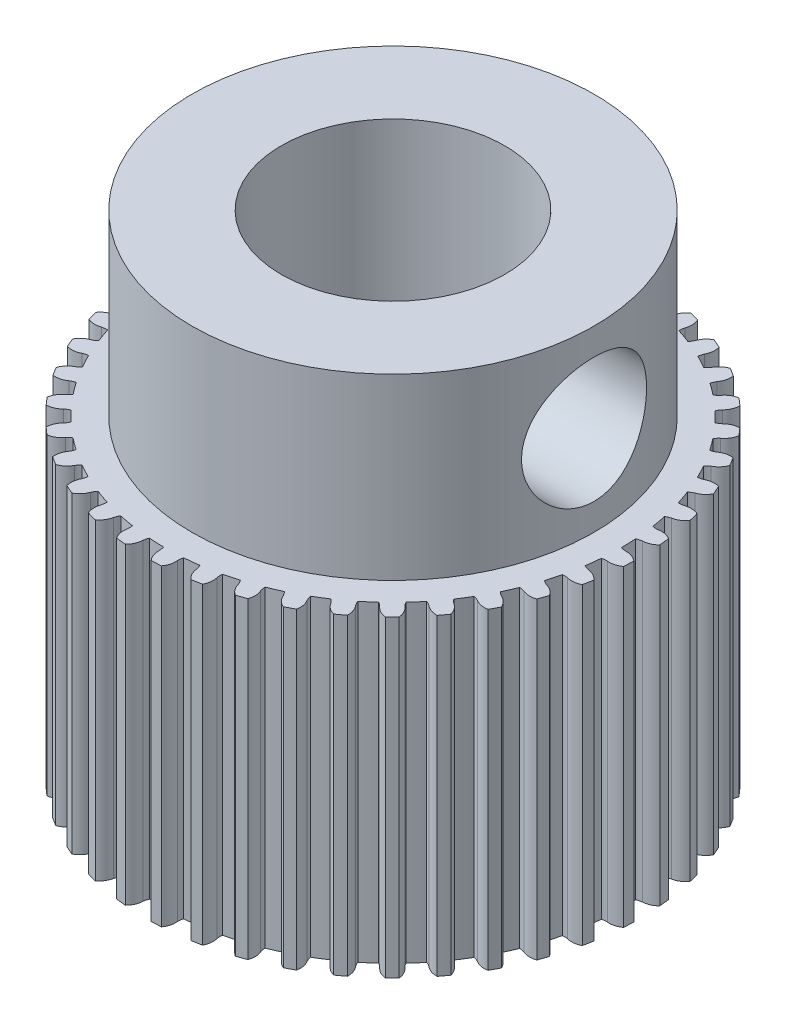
SolidWorks part; units mm, degrees
ref_plane "Alzado" through (0, 0, 0) normal (0, 0, 1) x (1, 0, 0)
ref_plane "Planta" through (0, 0, 0) normal (0, 1, 0) x (1, 0, 0)
ref_plane "Vista lateral" through (0, 0, 0) normal (1, 0, 0) x (0, 0, -1)
sketch "Croquis1" plane through (0, 0, 0) normal (0, 1, 0) x (1, 0, 0)
  arc A0 (1.5525, 4.9833) -> (1.539, 4.8622) centre (1.9387, 4.8789) ccw
  arc A1 (1.5525, 4.9833) -> (1.5407, 5.2798) centre (1.1754, 5.1167) ccw
  arc A2 (0.7366, 5.4505) -> (0.5179, 5.4756) centre (0, 0) ccw
  arc A3 (1.5407, 5.2798) -> (1.3282, 5.3372) centre (0, 0) ccw
  arc A4 (0.7925, 5.159) -> (0.7366, 5.4505) centre (0.3997, 5.2348) ccw
  arc A5 (0.5179, 5.4756) -> (0.3974, 5.2044) centre (0.7971, 5.1891) ccw
  arc A6 (0.7925, 5.159) -> (0.7972, 5.0373) centre (1.1899, 5.1134) ccw
  arc A7 (1.3282, 5.3372) -> (1.1686, 5.087) centre (1.5616, 5.0124) ccw
  arc A8 (1.1193, 4.9757) -> (1.1686, 5.087) centre (0.7825, 5.1914) ccw
  arc A9 (0.3652, 5.0869) -> (0.3974, 5.2044) centre (0, 5.25) ccw
  arc A10 (2.2779, 4.6962) -> (2.2465, 4.5786) centre (2.6442, 4.5355) ccw
  arc A11 (2.2779, 4.6962) -> (2.3104, 4.9912) centre (1.9249, 4.8844) ccw
  arc A12 (2.3104, 4.9912) -> (2.1088, 5.0796) centre (0, 0) ccw
  arc A13 (2.1088, 5.0796) -> (1.9138, 4.856) centre (2.2912, 4.7236) ccw
  arc A14 (1.8484, 4.7533) -> (1.9138, 4.856) centre (1.5475, 5.0168) ccw
  arc A15 (2.9524, 4.3043) -> (2.9038, 4.1926) centre (3.2906, 4.0907) ccw
  arc A16 (2.9524, 4.3043) -> (3.0285, 4.5911) centre (2.6314, 4.5429) ccw
  arc A17 (3.0285, 4.5911) -> (2.8424, 4.7086) centre (0, 0) ccw
  arc A18 (2.8424, 4.7086) -> (2.6161, 4.5166) centre (2.9696, 4.3294) ccw
  arc A19 (2.5362, 4.4247) -> (2.6161, 4.5166) centre (2.2779, 4.7301) ccw
  arc A20 (3.5609, 3.8162) -> (3.4963, 3.713) centre (3.8636, 3.5546) ccw
  arc A21 (3.5609, 3.8162) -> (3.6789, 4.0885) centre (3.2791, 4.1) ccw
  arc A22 (3.6789, 4.0885) -> (3.5124, 4.2324) centre (0, 0) ccw
  arc A23 (3.5124, 4.2324) -> (3.2601, 4.0762) centre (3.5817, 3.8384) ccw
  arc A24 (3.1673, 3.9973) -> (3.2601, 4.0762) centre (2.9574, 4.3378) ccw
  arc A25 (4.0899, 3.2428) -> (4.0106, 3.1504) centre (4.3502, 2.9391) ccw
  arc A26 (4.0899, 3.2428) -> (4.2472, 3.4945) centre (3.8536, 3.5655) ccw
  arc A27 (4.2472, 3.4945) -> (4.104, 3.6616) centre (0, 0) ccw
  arc A28 (4.104, 3.6616) -> (3.8312, 3.5448) centre (4.1138, 3.2617) ccw
  arc A29 (3.7277, 3.4805) -> (3.8312, 3.5448) centre (3.5709, 3.8485) ccw
  arc A30 (4.5276, 2.597) -> (4.4354, 2.5175) centre (4.7397, 2.2579) ccw
  arc A31 (4.5276, 2.597) -> (4.7206, 2.8224) centre (4.3419, 2.9513) ccw
  arc A32 (4.7206, 2.8224) -> (4.6039, 3.0091) centre (0, 0) ccw
  arc A33 (4.6039, 3.0091) -> (4.3167, 2.9342) centre (4.554, 2.6122) ccw
  arc A34 (4.2048, 2.8861) -> (4.3167, 2.9342) centre (4.1046, 3.2733) ccw
  arc A35 (4.8641, 1.8932) -> (4.761, 1.8283) centre (5.0233, 1.5262) ccw
  arc A36 (4.8641, 1.8932) -> (5.0885, 2.0873) centre (4.7333, 2.2712) ccw
  arc A37 (5.0885, 2.0873) -> (5.0009, 2.2893) centre (0, 0) ccw
  arc A38 (5.0009, 2.2893) -> (4.7058, 2.258) centre (4.8925, 1.9043) ccw
  arc A39 (4.588, 2.2271) -> (4.7058, 2.258) centre (4.5466, 2.625) ccw
  arc A40 (5.0919, 1.1471) -> (4.9803, 1.0983) centre (5.1946, 0.7605) ccw
  arc A41 (5.0919, 1.1471) -> (5.3428, 1.3056) centre (5.0189, 1.5404) ccw
  arc A42 (5.3428, 1.3056) -> (5.2863, 1.5184) centre (0, 0) ccw
  arc A43 (5.2863, 1.5184) -> (4.9898, 1.5315) centre (5.1216, 1.1538) ccw
  arc A44 (4.8687, 1.5185) -> (4.9898, 1.5315) centre (4.8871, 1.918) ccw
  arc A45 (5.206, 0.3754) -> (5.0884, 0.3437) centre (5.25, -0.0222) ccw
  arc A46 (5.206, 0.3754) -> (5.4777, 0.4947) centre (5.1925, 0.7752) ccw
  arc A47 (5.4777, 0.4947) -> (5.4535, 0.7135) centre (0, 0) ccw
  arc A48 (5.4535, 0.7135) -> (5.1623, 0.7707) centre (5.2364, 0.3776) ccw
  arc A49 (5.0406, 0.7759) -> (5.1623, 0.7707) centre (5.1184, 1.1682) ccw
  arc A50 (5.2038, -0.4047) -> (5.0828, -0.4185) centre (5.188, -0.8044) ccw
  arc A51 (5.2038, -0.4047) -> (5.4903, -0.3272) centre (5.25, -0.0074) ccw
  arc A52 (5.4903, -0.3272) -> (5.499, -0.1072) centre (0, 0) ccw
  arc A53 (5.499, -0.1072) -> (5.2195, -0.0074) centre (5.2342, -0.4071) ccw
  arc A54 (5.1, 0.0159) -> (5.2195, -0.0074) centre (5.2353, 0.3923) ccw
  arc A55 (5.0854, -1.1758) -> (4.9637, -1.1714) centre (5.0102, -1.5687) ccw
  arc A56 (5.0854, -1.1758) -> (5.3802, -1.1418) centre (5.1903, -0.7898) ccw
  arc A57 (5.3802, -1.1418) -> (5.4216, -0.9256) centre (0, 0) ccw
  arc A58 (5.4216, -0.9256) -> (5.1601, -0.7852) centre (5.1151, -1.1827) ccw
  arc A59 (5.0454, -0.7444) -> (5.1601, -0.7852) centre (5.2353, -0.3923) ccw
  arc A60 (4.8533, -1.9206) -> (4.7336, -1.8981) centre (4.7204, -2.2979) ccw
  arc A61 (4.8533, -1.9206) -> (5.1499, -1.9309) centre (5.0146, -1.5545) ccw
  arc A62 (5.1499, -1.9309) -> (5.223, -1.7233) centre (0, 0) ccw
  arc A63 (5.223, -1.7233) -> (4.9855, -1.5455) centre (4.8817, -1.9318) ccw
  arc A64 (4.8781, -1.488) -> (4.9855, -1.5455) centre (5.1184, -1.1682) ccw
  arc A65 (4.5129, -2.6225) -> (4.3979, -2.5824) centre (4.3252, -2.9757) ccw
  arc A66 (4.5129, -2.6225) -> (4.8046, -2.6769) centre (4.7269, -2.2846) ccw
  arc A67 (4.8046, -2.6769) -> (4.9079, -2.4825) centre (0, 0) ccw
  arc A68 (4.9079, -2.4825) -> (4.6994, -2.2713) centre (4.5392, -2.6378) ccw
  arc A69 (4.6018, -2.1984) -> (4.6994, -2.2713) centre (4.8871, -1.918) ccw
  arc A70 (4.0716, -3.2658) -> (3.9639, -3.209) centre (3.8334, -3.5871) ccw
  arc A71 (4.0716, -3.2658) -> (4.3519, -3.3631) centre (4.3336, -2.9635) ccw
  arc A72 (4.3519, -3.3631) -> (4.483, -3.1863) centre (0, 0) ccw
  arc A73 (4.483, -3.1863) -> (4.3084, -2.9463) centre (4.0954, -3.2849) ccw
  arc A74 (4.2228, -2.8598) -> (4.3084, -2.9463) centre (4.5466, -2.625) ccw
  arc A75 (3.5394, -3.8362) -> (3.4413, -3.764) centre (3.2559, -4.1184) ccw
  arc A76 (3.5394, -3.8362) -> (3.8021, -3.9742) centre (3.8435, -3.5763) ccw
  arc A77 (3.8021, -3.9742) -> (3.9581, -3.8189) centre (0, 0) ccw
  arc A78 (3.9581, -3.8189) -> (3.8212, -3.5556) centre (3.56, -3.8586) ccw
  arc A79 (3.7494, -3.4572) -> (3.8212, -3.5556) centre (4.1046, -3.2733) ccw
  arc A80 (2.9281, -4.3208) -> (2.8419, -4.2348) centre (2.6058, -4.5577) ccw
  arc A81 (2.9281, -4.3208) -> (3.1673, -4.4965) centre (3.2675, -4.1092) ccw
  arc A82 (3.1673, -4.4965) -> (3.3447, -4.3661) centre (0, 0) ccw
  arc A83 (3.3447, -4.3661) -> (3.2486, -4.0854) centre (2.9452, -4.3461) ccw
  arc A84 (3.1922, -3.9774) -> (3.2486, -4.0854) centre (3.5709, -3.8485) ccw
  arc A85 (2.2514, -4.709) -> (2.179, -4.6111) centre (1.8974, -4.8952) ccw
  arc A86 (2.2514, -4.709) -> (2.4618, -4.9183) centre (2.6186, -4.5503) ccw
  arc A87 (2.4618, -4.9183) -> (2.6566, -4.8159) centre (0, 0) ccw
  arc A88 (2.6566, -4.8159) -> (2.6034, -4.5239) centre (2.2646, -4.7365) ccw
  arc A89 (2.5638, -4.4087) -> (2.6034, -4.5239) centre (2.9574, -4.3378) ccw
  arc A90 (1.5244, -4.992) -> (1.4674, -4.8843) centre (1.1466, -5.1233) ccw
  arc A91 (1.5244, -4.992) -> (1.7012, -5.2303) centre (1.9112, -4.8898) ccw
  arc A92 (1.7012, -5.2303) -> (1.9092, -5.158) centre (0, 0) ccw
  arc A93 (1.9092, -5.158) -> (1.9001, -4.8614) centre (1.5333, -5.0211) ccw
  arc A94 (1.8781, -4.7416) -> (1.9001, -4.8614) centre (2.2779, -4.7301) ccw
  arc A95 (0.7634, -5.1634) -> (0.723, -5.0485) centre (0.3702, -5.2369) ccw
  arc A96 (0.7634, -5.1634) -> (0.9027, -5.4254) centre (1.161, -5.12) ccw
  arc A97 (0.9027, -5.4254) -> (1.1191, -5.3849) centre (0, 0) ccw
  arc A98 (1.1191, -5.3849) -> (1.1543, -5.0903) centre (0.7678, -5.1935) ccw
  arc A99 (1.1504, -4.9686) -> (1.1543, -5.0903) centre (1.5475, -5.0168) ccw
  arc A100 (-0.0147, -5.2195) -> (-0.0375, -5.0999) centre (-0.4145, -5.2336) ccw
  arc A101 (-0.0147, -5.2195) -> (0.084, -5.4994) centre (0.385, -5.2359) ccw
  arc A102 (0.084, -5.4994) -> (0.304, -5.4916) centre (0, 0) ccw
  arc A103 (0.304, -5.4916) -> (0.3827, -5.2055) centre (-0.0148, -5.25) ccw
  arc A104 (0.397, -5.0845) -> (0.3827, -5.2055) centre (0.7825, -5.1914) ccw
  arc A105 (-0.7925, -5.159) -> (-0.7972, -5.0373) centre (-1.1899, -5.1134) ccw
  arc A106 (-0.7925, -5.159) -> (-0.7366, -5.4505) centre (-0.3997, -5.2348) ccw
  arc A107 (-0.7366, -5.4505) -> (-0.5179, -5.4756) centre (0, 0) ccw
  arc A108 (-0.5179, -5.4756) -> (-0.3974, -5.2044) centre (-0.7971, -5.1891) ccw
  arc A109 (-0.3652, -5.0869) -> (-0.3974, -5.2044) centre (0, -5.25) ccw
  arc A110 (-1.5525, -4.9833) -> (-1.539, -4.8622) centre (-1.9387, -4.8789) ccw
  arc A111 (-1.5525, -4.9833) -> (-1.5407, -5.2798) centre (-1.1754, -5.1167) ccw
  arc A112 (-1.5407, -5.2798) -> (-1.3282, -5.3372) centre (0, 0) ccw
  arc A113 (-1.3282, -5.3372) -> (-1.1686, -5.087) centre (-1.5616, -5.0124) ccw
  arc A114 (-1.1193, -4.9757) -> (-1.1686, -5.087) centre (-0.7825, -5.1914) ccw
  arc A115 (-2.2779, -4.6962) -> (-2.2465, -4.5786) centre (-2.6442, -4.5355) ccw
  arc A116 (-2.2779, -4.6962) -> (-2.3104, -4.9912) centre (-1.9249, -4.8844) ccw
  arc A117 (-2.3104, -4.9912) -> (-2.1088, -5.0796) centre (0, 0) ccw
  arc A118 (-2.1088, -5.0796) -> (-1.9138, -4.856) centre (-2.2912, -4.7236) ccw
  arc A119 (-1.8484, -4.7533) -> (-1.9138, -4.856) centre (-1.5475, -5.0168) ccw
  arc A120 (-2.9524, -4.3043) -> (-2.9038, -4.1926) centre (-3.2906, -4.0907) ccw
  arc A121 (-2.9524, -4.3043) -> (-3.0285, -4.5911) centre (-2.6314, -4.5429) ccw
  arc A122 (-3.0285, -4.5911) -> (-2.8424, -4.7086) centre (0, 0) ccw
  arc A123 (-2.8424, -4.7086) -> (-2.6161, -4.5166) centre (-2.9696, -4.3294) ccw
  arc A124 (-2.5362, -4.4247) -> (-2.6161, -4.5166) centre (-2.2779, -4.7301) ccw
  arc A125 (-3.5609, -3.8162) -> (-3.4963, -3.713) centre (-3.8636, -3.5546) ccw
  arc A126 (-3.5609, -3.8162) -> (-3.6789, -4.0885) centre (-3.2791, -4.1) ccw
  arc A127 (-3.6789, -4.0885) -> (-3.5124, -4.2324) centre (0, 0) ccw
  arc A128 (-3.5124, -4.2324) -> (-3.2601, -4.0762) centre (-3.5817, -3.8384) ccw
  arc A129 (-3.1673, -3.9973) -> (-3.2601, -4.0762) centre (-2.9574, -4.3378) ccw
  arc A130 (-4.0899, -3.2428) -> (-4.0106, -3.1504) centre (-4.3502, -2.9391) ccw
  arc A131 (-4.0899, -3.2428) -> (-4.2472, -3.4945) centre (-3.8536, -3.5655) ccw
  arc A132 (-4.2472, -3.4945) -> (-4.104, -3.6616) centre (0, 0) ccw
  arc A133 (-4.104, -3.6616) -> (-3.8312, -3.5448) centre (-4.1138, -3.2617) ccw
  arc A134 (-3.7277, -3.4805) -> (-3.8312, -3.5448) centre (-3.5709, -3.8485) ccw
  arc A135 (-4.5276, -2.597) -> (-4.4354, -2.5175) centre (-4.7397, -2.2579) ccw
  arc A136 (-4.5276, -2.597) -> (-4.7206, -2.8224) centre (-4.3419, -2.9513) ccw
  arc A137 (-4.7206, -2.8224) -> (-4.6039, -3.0091) centre (0, 0) ccw
  arc A138 (-4.6039, -3.0091) -> (-4.3167, -2.9342) centre (-4.554, -2.6122) ccw
  arc A139 (-4.2048, -2.8861) -> (-4.3167, -2.9342) centre (-4.1046, -3.2733) ccw
  arc A140 (-4.8641, -1.8932) -> (-4.761, -1.8283) centre (-5.0233, -1.5262) ccw
  arc A141 (-4.8641, -1.8932) -> (-5.0885, -2.0873) centre (-4.7333, -2.2712) ccw
  arc A142 (-5.0885, -2.0873) -> (-5.0009, -2.2893) centre (0, 0) ccw
  arc A143 (-5.0009, -2.2893) -> (-4.7058, -2.258) centre (-4.8925, -1.9043) ccw
  arc A144 (-4.588, -2.2271) -> (-4.7058, -2.258) centre (-4.5466, -2.625) ccw
  arc A145 (-5.0919, -1.1471) -> (-4.9803, -1.0983) centre (-5.1946, -0.7605) ccw
  arc A146 (-5.0919, -1.1471) -> (-5.3428, -1.3056) centre (-5.0189, -1.5404) ccw
  arc A147 (-5.3428, -1.3056) -> (-5.2863, -1.5184) centre (0, 0) ccw
  arc A148 (-5.2863, -1.5184) -> (-4.9898, -1.5315) centre (-5.1216, -1.1538) ccw
  arc A149 (-4.8687, -1.5185) -> (-4.9898, -1.5315) centre (-4.8871, -1.918) ccw
  arc A150 (-5.206, -0.3754) -> (-5.0884, -0.3437) centre (-5.25, 0.0222) ccw
  arc A151 (-5.206, -0.3754) -> (-5.4777, -0.4947) centre (-5.1925, -0.7752) ccw
  arc A152 (-5.4777, -0.4947) -> (-5.4535, -0.7135) centre (0, 0) ccw
  arc A153 (-5.4535, -0.7135) -> (-5.1623, -0.7707) centre (-5.2364, -0.3776) ccw
  arc A154 (-5.0406, -0.7759) -> (-5.1623, -0.7707) centre (-5.1184, -1.1682) ccw
  arc A155 (-5.2038, 0.4047) -> (-5.0828, 0.4185) centre (-5.188, 0.8044) ccw
  arc A156 (-5.2038, 0.4047) -> (-5.4903, 0.3272) centre (-5.25, 0.0074) ccw
  arc A157 (-5.4903, 0.3272) -> (-5.499, 0.1072) centre (0, 0) ccw
  arc A158 (-5.499, 0.1072) -> (-5.2195, 0.0074) centre (-5.2342, 0.4071) ccw
  arc A159 (-5.1, -0.0159) -> (-5.2195, 0.0074) centre (-5.2353, -0.3923) ccw
  arc A160 (-5.0854, 1.1758) -> (-4.9637, 1.1714) centre (-5.0102, 1.5687) ccw
  arc A161 (-5.0854, 1.1758) -> (-5.3802, 1.1418) centre (-5.1903, 0.7898) ccw
  arc A162 (-5.3802, 1.1418) -> (-5.4216, 0.9256) centre (0, 0) ccw
  arc A163 (-5.4216, 0.9256) -> (-5.1601, 0.7852) centre (-5.1151, 1.1827) ccw
  arc A164 (-5.0454, 0.7444) -> (-5.1601, 0.7852) centre (-5.2353, 0.3923) ccw
  arc A165 (-4.8533, 1.9206) -> (-4.7336, 1.8981) centre (-4.7204, 2.2979) ccw
  arc A166 (-4.8533, 1.9206) -> (-5.1499, 1.9309) centre (-5.0146, 1.5545) ccw
  arc A167 (-5.1499, 1.9309) -> (-5.223, 1.7233) centre (0, 0) ccw
  arc A168 (-5.223, 1.7233) -> (-4.9855, 1.5455) centre (-4.8817, 1.9318) ccw
  arc A169 (-4.8781, 1.488) -> (-4.9855, 1.5455) centre (-5.1184, 1.1682) ccw
  arc A170 (-4.5129, 2.6225) -> (-4.3979, 2.5824) centre (-4.3252, 2.9757) ccw
  arc A171 (-4.5129, 2.6225) -> (-4.8046, 2.6769) centre (-4.7269, 2.2846) ccw
  arc A172 (-4.8046, 2.6769) -> (-4.9079, 2.4825) centre (0, 0) ccw
  arc A173 (-4.9079, 2.4825) -> (-4.6994, 2.2713) centre (-4.5392, 2.6378) ccw
  arc A174 (-4.6018, 2.1984) -> (-4.6994, 2.2713) centre (-4.8871, 1.918) ccw
  arc A175 (-4.0716, 3.2658) -> (-3.9639, 3.209) centre (-3.8334, 3.5871) ccw
  arc A176 (-4.0716, 3.2658) -> (-4.3519, 3.3631) centre (-4.3336, 2.9635) ccw
  arc A177 (-4.3519, 3.3631) -> (-4.483, 3.1863) centre (0, 0) ccw
  arc A178 (-4.483, 3.1863) -> (-4.3084, 2.9463) centre (-4.0954, 3.2849) ccw
  arc A179 (-4.2228, 2.8598) -> (-4.3084, 2.9463) centre (-4.5466, 2.625) ccw
  arc A180 (-3.5394, 3.8362) -> (-3.4413, 3.764) centre (-3.2559, 4.1184) ccw
  arc A181 (-3.5394, 3.8362) -> (-3.8021, 3.9742) centre (-3.8435, 3.5763) ccw
  arc A182 (-3.8021, 3.9742) -> (-3.9581, 3.8189) centre (0, 0) ccw
  arc A183 (-3.9581, 3.8189) -> (-3.8212, 3.5556) centre (-3.56, 3.8586) ccw
  arc A184 (-3.7494, 3.4572) -> (-3.8212, 3.5556) centre (-4.1046, 3.2733) ccw
  arc A185 (-2.9281, 4.3208) -> (-2.8419, 4.2348) centre (-2.6058, 4.5577) ccw
  arc A186 (-2.9281, 4.3208) -> (-3.1673, 4.4965) centre (-3.2675, 4.1092) ccw
  arc A187 (-3.1673, 4.4965) -> (-3.3447, 4.3661) centre (0, 0) ccw
  arc A188 (-3.3447, 4.3661) -> (-3.2486, 4.0854) centre (-2.9452, 4.3461) ccw
  arc A189 (-3.1922, 3.9774) -> (-3.2486, 4.0854) centre (-3.5709, 3.8485) ccw
  arc A190 (-2.2514, 4.709) -> (-2.179, 4.6111) centre (-1.8974, 4.8952) ccw
  arc A191 (-2.2514, 4.709) -> (-2.4618, 4.9183) centre (-2.6186, 4.5503) ccw
  arc A192 (-2.4618, 4.9183) -> (-2.6566, 4.8159) centre (0, 0) ccw
  arc A193 (-2.6566, 4.8159) -> (-2.6034, 4.5239) centre (-2.2646, 4.7365) ccw
  arc A194 (-2.5638, 4.4087) -> (-2.6034, 4.5239) centre (-2.9574, 4.3378) ccw
  arc A195 (-1.5244, 4.992) -> (-1.4674, 4.8843) centre (-1.1466, 5.1233) ccw
  arc A196 (-1.5244, 4.992) -> (-1.7012, 5.2303) centre (-1.9112, 4.8898) ccw
  arc A197 (-1.7012, 5.2303) -> (-1.9092, 5.158) centre (0, 0) ccw
  arc A198 (-1.9092, 5.158) -> (-1.9001, 4.8614) centre (-1.5333, 5.0211) ccw
  arc A199 (-1.8781, 4.7416) -> (-1.9001, 4.8614) centre (-2.2779, 4.7301) ccw
  arc A200 (-0.7634, 5.1634) -> (-0.723, 5.0485) centre (-0.3702, 5.2369) ccw
  arc A201 (-0.7634, 5.1634) -> (-0.9027, 5.4254) centre (-1.161, 5.12) ccw
  arc A202 (-0.9027, 5.4254) -> (-1.1191, 5.3849) centre (0, 0) ccw
  arc A203 (-1.1191, 5.3849) -> (-1.1543, 5.0903) centre (-0.7678, 5.1935) ccw
  arc A204 (-1.1504, 4.9686) -> (-1.1543, 5.0903) centre (-1.5475, 5.0168) ccw
  arc A205 (0.0147, 5.2195) -> (0.0375, 5.0999) centre (0.4145, 5.2336) ccw
  arc A206 (0.0147, 5.2195) -> (-0.084, 5.4994) centre (-0.385, 5.2359) ccw
  arc A207 (-0.084, 5.4994) -> (-0.304, 5.4916) centre (0, 0) ccw
  arc A208 (-0.304, 5.4916) -> (-0.3827, 5.2055) centre (0.0148, 5.25) ccw
  arc A209 (-0.397, 5.0845) -> (-0.3827, 5.2055) centre (-0.7825, 5.1914) ccw
  arc A210 (-1.8781, 4.7416) -> (-2.179, 4.6111) centre (0, 0) ccw
  arc A211 (-1.1504, 4.9686) -> (-1.4674, 4.8843) centre (0, 0) ccw
  arc A212 (-0.397, 5.0845) -> (-0.723, 5.0485) centre (0, 0) ccw
  arc A213 (-2.5638, 4.4087) -> (-2.8419, 4.2348) centre (0, 0) ccw
  arc A214 (-3.1922, 3.9774) -> (-3.4413, 3.764) centre (0, 0) ccw
  arc A215 (0.3652, 5.0869) -> (0.0375, 5.0999) centre (0, 0) ccw
  arc A216 (1.1193, 4.9757) -> (0.7972, 5.0373) centre (0, 0) ccw
  arc A217 (1.8484, 4.7533) -> (1.539, 4.8622) centre (0, 0) ccw
  arc A218 (2.5362, 4.4247) -> (2.2465, 4.5786) centre (0, 0) ccw
  arc A219 (3.1673, 3.9973) -> (2.9038, 4.1926) centre (0, 0) ccw
  arc A220 (-3.7494, 3.4572) -> (-3.9639, 3.209) centre (0, 0) ccw
  arc A221 (-4.2228, 2.8598) -> (-4.3979, 2.5824) centre (0, 0) ccw
  arc A222 (-4.6018, 2.1984) -> (-4.7336, 1.8981) centre (0, 0) ccw
  arc A223 (-4.8781, 1.488) -> (-4.9637, 1.1714) centre (0, 0) ccw
  arc A224 (-5.0454, 0.7444) -> (-5.0828, 0.4185) centre (0, 0) ccw
  arc A225 (-5.1, -0.0159) -> (-5.0884, -0.3437) centre (0, 0) ccw
  arc A226 (-5.0406, -0.7759) -> (-4.9803, -1.0983) centre (0, 0) ccw
  arc A227 (-4.8687, -1.5185) -> (-4.761, -1.8283) centre (0, 0) ccw
  arc A228 (-4.588, -2.2271) -> (-4.4354, -2.5175) centre (0, 0) ccw
  arc A229 (-4.2048, -2.8861) -> (-4.0106, -3.1504) centre (0, 0) ccw
  arc A230 (-3.7277, -3.4805) -> (-3.4963, -3.713) centre (0, 0) ccw
  arc A231 (-3.1673, -3.9973) -> (-2.9038, -4.1926) centre (0, 0) ccw
  arc A232 (-2.5362, -4.4247) -> (-2.2465, -4.5786) centre (0, 0) ccw
  arc A233 (-1.8484, -4.7533) -> (-1.539, -4.8622) centre (0, 0) ccw
  arc A234 (-1.1193, -4.9757) -> (-0.7972, -5.0373) centre (0, 0) ccw
  arc A235 (-0.3652, -5.0869) -> (-0.0375, -5.0999) centre (0, 0) ccw
  arc A236 (0.397, -5.0845) -> (0.723, -5.0485) centre (0, 0) ccw
  arc A237 (1.1504, -4.9686) -> (1.4674, -4.8843) centre (0, 0) ccw
  arc A238 (1.8781, -4.7416) -> (2.179, -4.6111) centre (0, 0) ccw
  arc A239 (2.5638, -4.4087) -> (2.8419, -4.2348) centre (0, 0) ccw
  arc A240 (3.1922, -3.9774) -> (3.4413, -3.764) centre (0, 0) ccw
  arc A241 (3.7494, -3.4572) -> (3.9639, -3.209) centre (0, 0) ccw
  arc A242 (4.2228, -2.8598) -> (4.3979, -2.5824) centre (0, 0) ccw
  arc A243 (4.6018, -2.1984) -> (4.7336, -1.8981) centre (0, 0) ccw
  arc A244 (4.8781, -1.488) -> (4.9637, -1.1714) centre (0, 0) ccw
  arc A245 (5.0454, -0.7444) -> (5.0828, -0.4185) centre (0, 0) ccw
  arc A246 (5.1, 0.0159) -> (5.0884, 0.3437) centre (0, 0) ccw
  arc A247 (3.7277, 3.4805) -> (3.4963, 3.713) centre (0, 0) ccw
  arc A248 (4.2048, 2.8861) -> (4.0106, 3.1504) centre (0, 0) ccw
  arc A249 (4.588, 2.2271) -> (4.4354, 2.5175) centre (0, 0) ccw
  arc A250 (4.8687, 1.5185) -> (4.761, 1.8283) centre (0, 0) ccw
  arc A251 (5.0406, 0.7759) -> (4.9803, 1.0983) centre (0, 0) ccw
  circle A252 centre (0, 0) radius 2.5
  point P424 (0, 0)
  dimension "D1" = 42
extrude "Saliente-Extruir1" add sketch "Croquis1" along normal blind 7
sketch "Croquis2" plane through (0, 7, 0) normal (0, 1, 0) x (1, 0, 0)
  circle A0 centre (0, 0) radius 2.5
  circle A1 centre (0, 0) radius 4.5
extrude "Saliente-Extruir2" add sketch "Croquis2" along normal blind 4
ref_plane "Plano1" through (4.5, 0, 0) normal (1, 0, 0) x (0, 0, -1)
sketch "Croquis3" plane through (4.5, 0, 0) normal (1, 0, 0) x (0, 0, -1)
  circle A0 centre (0, 9) radius 1.4
extrude "Cortar-Extruir1" cut sketch "Croquis3" against normal up to next contours A0
